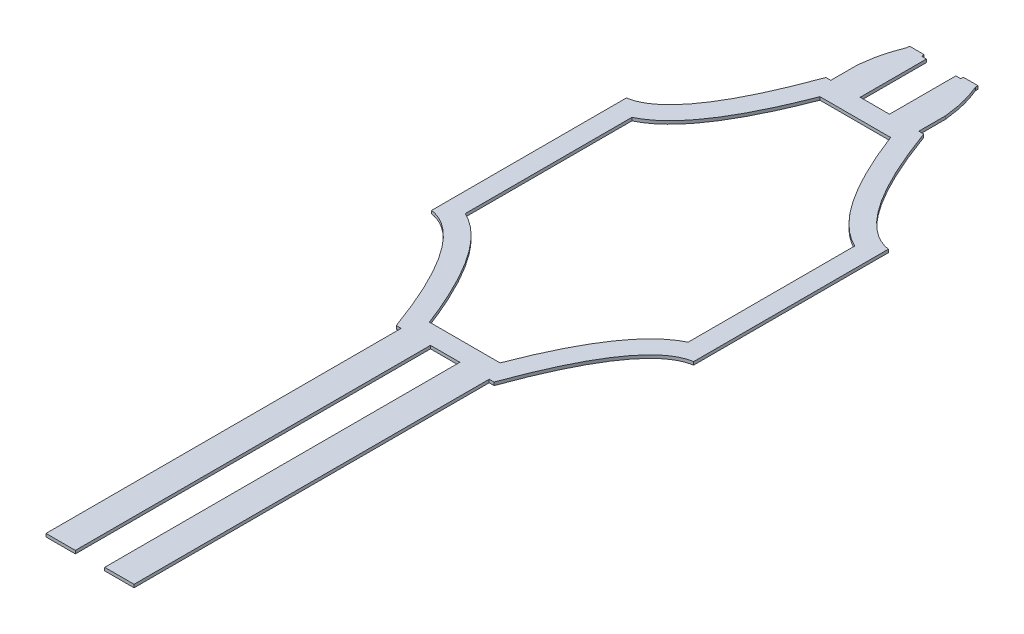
SolidWorks part; units mm, degrees
ref_plane "Front Plane" through (0, 0, 0) normal (0, 0, 1) x (1, 0, 0)
ref_plane "Top Plane" through (0, 0, 0) normal (0, 1, 0) x (1, 0, 0)
ref_plane "Right Plane" through (0, 0, 0) normal (1, 0, 0) x (0, 0, -1)
sketch "Sketch2" plane through (0, 0, 0) normal (0, 1, 0) x (1, 0, 0)
  line L0 (-133.879, 11.9109) -> (133.879, 11.9109) construction
  line L1 (133.879, -87.6641) -> (133.879, 111.4859)
  line L2 (-113.879, -87.6641) -> (-113.879, 111.4859) construction
  line L3 (-50, 231.4859) -> (-45, 231.4859)
  line L4 (-133.879, -87.6641) -> (-133.879, 111.4859)
  line L5 (133.879, -87.6641) -> (133.879, 111.4859)
  line L6 (-133.879, -87.6641) -> (-133.879, 111.4859)
  line L7 (-50, -207.6641) -> (-45, -207.6641)
  line L8 (0, -207.6641) -> (0, 231.4859) construction
  line L9 (-36.1093, 211.4859) -> (36.1093, 211.4859)
  line L10 (-113.879, -73.2186) -> (-113.879, 97.0404)
  line L11 (-113.879, -87.6641) -> (-113.879, 111.4859) construction
  line L12 (-113.879, -73.2186) -> (-113.879, 97.0404)
  line L13 (113.879, -87.6641) -> (113.879, 111.4859) construction
  line L14 (113.879, -73.2186) -> (113.879, 97.0404)
  line L15 (113.879, -87.6641) -> (113.879, 111.4859) construction
  line L16 (45, 231.4859) -> (45, 234.6609)
  line L17 (113.879, -73.2186) -> (113.879, 97.0404)
  line L18 (-35, 299.2853) -> (-35, 301.9482)
  line L19 (-36.1093, -187.6641) -> (36.1093, -187.6641)
  line L20 (15, 234.6609) -> (15, 231.4859)
  line L21 (45, 231.4859) -> (50, 231.4859)
  line L22 (-50, 231.4859) -> (50, 231.4859) construction
  line L23 (50, 231.4859) -> (45, 231.4859)
  line L24 (-15, 234.6609) -> (-15, 231.4859)
  line L25 (15, 258.9084) -> (15, 299.2853)
  line L26 (-45, 231.4859) -> (-45, 234.6609)
  line L27 (15, 231.4859) -> (-15, 231.4859)
  line L28 (-15, 231.4859) -> (15, 231.4859)
  line L29 (-45, -207.6641) -> (-45, -570.6641)
  line L30 (-45, -570.6641) -> (-15, -570.6641)
  line L31 (-15, -570.6641) -> (-15, -207.6641)
  line L32 (15, -207.6641) -> (15, -570.6641)
  line L33 (15, -570.6641) -> (45, -570.6641)
  line L34 (45, -570.6641) -> (45, -207.6641)
  line L35 (-15, -207.6641) -> (15, -207.6641)
  line L36 (-50, -207.6641) -> (50, -207.6641) construction
  line L37 (45, -207.6641) -> (50, -207.6641)
  line L38 (0, 231.4859) -> (0, 322.56) construction
  line L39 (20, 299.2853) -> (15, 299.2853)
  line L40 (-45, 258.9084) -> (-45, 234.6609)
  line L41 (15, 258.9084) -> (15, 234.6609)
  line L42 (-15, 258.9084) -> (-15, 234.6609)
  line L43 (-20, 299.2853) -> (-15, 299.2853)
  line L44 (-15, 258.9084) -> (-15, 299.2853)
  line L45 (45, 258.9084) -> (45, 234.6609)
  line L46 (-35, 301.9482) -> (-20, 301.9482)
  line L47 (-20, 301.9482) -> (-20, 299.2853)
  line L48 (20, 301.9482) -> (20, 299.2853)
  line L49 (35, 301.9482) -> (20, 301.9482)
  line L50 (35, 299.2853) -> (35, 301.9482)
  spline S0 degree 3 poles (-50, -207.6641) (-84.0837, -113.4234) (-113.7872, -90.5134) (-133.879, -87.6641) knots 0.047958 0.047958 0.047958 0.047958 0.909986 0.909986 0.909986 0.909986
  spline S1 degree 3 poles (50, 231.4859) (84.0837, 137.2452) (113.7872, 114.3352) (133.879, 111.4859) knots 0.047958 0.047958 0.047958 0.047958 0.909986 0.909986 0.909986 0.909986
  spline S2 degree 3 poles (50, -207.6641) (84.0837, -113.4234) (113.7872, -90.5134) (133.879, -87.6641) knots 0.047958 0.047958 0.047958 0.047958 0.909986 0.909986 0.909986 0.909986
  spline S3 degree 3 poles (-50, 231.4859) (-84.0837, 137.2452) (-113.7872, 114.3352) (-133.879, 111.4859) knots 0.047958 0.047958 0.047958 0.047958 0.909986 0.909986 0.909986 0.909986
  spline S4 degree 1 poles (-36.1093, 211.4859) (-131.0708, 91.684) knots 0 0 1 1 construction
  spline S5 degree 1 poles (36.1093, 211.4859) (131.0708, 91.684) knots 0 0 1 1 construction
  spline S6 degree 3 poles (-131.0708, 91.684) (-130.1014, 91.8215) (-128.1875, 92.146) (-124.259, 93.0338) (-119.2899, 94.5914) (-113.2854, 97.2057) (-105.3085, 101.694) (-95.4649, 109.1915) (-83.8263, 121.3602) (-74.13, 134.4461) (-66.3044, 146.9285) (-60.3891, 157.3652) (-54.4181, 168.9456) (-49.3908, 179.6069) (-45.3359, 188.7785) (-42.2787, 195.9851) (-39.7147, 202.2785) (-37.6601, 207.4738) (-36.6209, 210.1537) (-36.1093, 211.4859) knots 0.088503 0.088503 0.088503 0.088503 0.114174 0.139846 0.191188 0.242531 0.293874 0.396559 0.499244 0.60193 0.653272 0.704615 0.755958 0.8073 0.832972 0.858643 0.884314 0.89715 0.909986 0.909986 0.909986 0.909986 only from (-113.879, 97.0404) to (-36.1093, 211.4859)
  spline S7 degree 3 poles (36.1093, 211.4859) (36.6209, 210.1537) (37.6601, 207.4738) (39.7147, 202.2785) (42.2787, 195.9851) (45.3359, 188.7785) (49.3908, 179.6069) (54.4181, 168.9456) (60.3891, 157.3652) (66.3044, 146.9285) (74.13, 134.4461) (83.8263, 121.3602) (95.4649, 109.1915) (105.3085, 101.694) (113.2854, 97.2057) (119.2899, 94.5914) (124.259, 93.0338) (128.1875, 92.146) (130.1014, 91.8215) (131.0708, 91.684) knots 0.088503 0.088503 0.088503 0.088503 0.101339 0.114174 0.139846 0.165517 0.191188 0.242531 0.293874 0.345216 0.396559 0.499244 0.60193 0.704615 0.755958 0.8073 0.858643 0.884314 0.909986 0.909986 0.909986 0.909986 only from (36.1093, 211.4859) to (113.879, 97.0404)
  spline S8 degree 3 poles (-45, 258.9084) (-43.419, 270.484) (-42.8305, 279.607) (-35, 299.2853) knots 0 0 0 0 1 1 1 1
  spline S9 degree 3 poles (45, 258.9084) (43.419, 270.484) (42.8305, 279.607) (35, 299.2853) knots 0 0 0 0 1 1 1 1
  spline S16 degree 1 poles (-36.1093, -187.6641) (-131.0708, -67.8622) knots 0 0 1 1 construction
  spline S17 degree 1 poles (36.1093, -187.6641) (131.0708, -67.8622) knots 0 0 1 1 construction
  spline S18 degree 3 poles (-131.0708, -67.8622) (-130.1014, -67.9997) (-128.1875, -68.3242) (-124.259, -69.212) (-119.2899, -70.7697) (-113.2854, -73.3839) (-105.3085, -77.8722) (-95.4649, -85.3697) (-83.8263, -97.5384) (-74.13, -110.6243) (-66.3044, -123.1067) (-60.3891, -133.5434) (-54.4181, -145.1238) (-49.3908, -155.7851) (-45.3359, -164.9568) (-42.2787, -172.1634) (-39.7147, -178.4567) (-37.6601, -183.652) (-36.6209, -186.3319) (-36.1093, -187.6641) knots 0.088503 0.088503 0.088503 0.088503 0.114174 0.139846 0.191188 0.242531 0.293874 0.396559 0.499244 0.60193 0.653272 0.704615 0.755958 0.8073 0.832972 0.858643 0.884314 0.89715 0.909986 0.909986 0.909986 0.909986 only from (-113.879, -73.2186) to (-36.1093, -187.6641)
  spline S19 degree 3 poles (36.1093, -187.6641) (36.6209, -186.3319) (37.6601, -183.652) (39.7147, -178.4567) (42.2787, -172.1634) (45.3359, -164.9568) (49.3908, -155.7851) (54.4181, -145.1238) (60.3891, -133.5434) (66.3044, -123.1067) (74.13, -110.6243) (83.8263, -97.5384) (95.4649, -85.3697) (105.3085, -77.8722) (113.2854, -73.3839) (119.2899, -70.7697) (124.259, -69.212) (128.1875, -68.3242) (130.1014, -67.9997) (131.0708, -67.8622) knots 0.088503 0.088503 0.088503 0.088503 0.101339 0.114174 0.139846 0.165517 0.191188 0.242531 0.293874 0.345216 0.396559 0.499244 0.60193 0.704615 0.755958 0.8073 0.858643 0.884314 0.909986 0.909986 0.909986 0.909986 only from (36.1093, -187.6641) to (113.879, -73.2186)
  point P14 (-133.879, 11.9109)
  point P15 (0, 0)
  point P16 (0, 11.9109)
  point P21 (0, 11.9109)
  dimension "D4" = 20
  dimension "D1" = 267.758
  dimension "D2" = 199.15
  dimension "D3" = 100
  dimension "D5" = 120
  dimension "D7" = 30
  dimension "D8" = 15
  dimension "D9" = 3.175
  dimension "D10" = 20
  dimension "D11" = 40.3769
  dimension "D12" = 67.7994
  dimension "D13" = 15
  dimension "D6" = 20
extrude "Boss-Extrude1" add sketch "Sketch2" along normal blind 3.175
